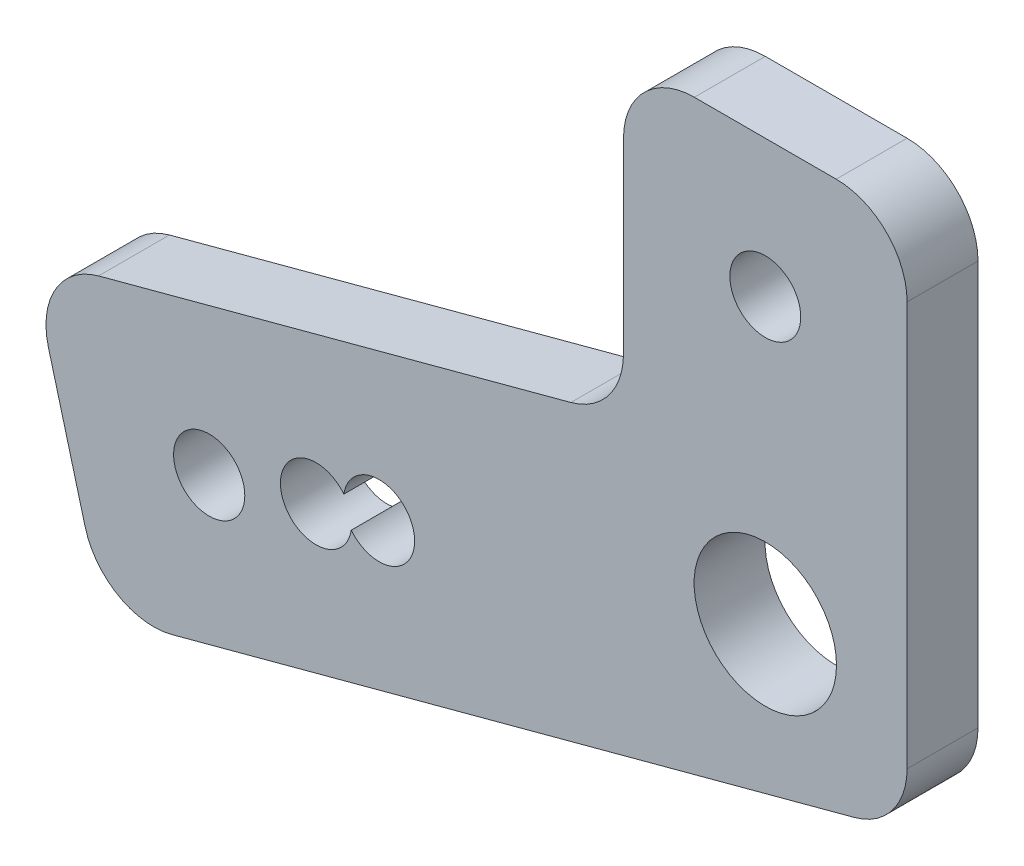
SolidWorks part; units mm, degrees
ref_plane "Front Plane" through (0, 0, 0) normal (0, 0, 1) x (1, 0, 0)
ref_plane "Top Plane" through (0, 0, 0) normal (0, 1, 0) x (1, 0, 0)
ref_plane "Right Plane" through (0, 0, 0) normal (1, 0, 0) x (0, 0, -1)
sketch "Sketch1" plane through (0, 0, 0) normal (0, 0, 1) x (1, 0, 0)
  line L0 (0, 0) -> (0, 60.96) construction
  line L1 (0, 0) -> (-49.8051, -13.3452) construction
  line L2 (-12.7, 9.7451) -> (-12.7, 37.6851)
  line L3 (12.7, -9.7451) -> (12.7, 37.6851)
  line L4 (12.7, -9.7451) -> (-59.276, -29.031)
  line L5 (-59.276, -29.031) -> (-65.85, -4.4965)
  line L6 (-65.85, -4.4965) -> (-12.7, 9.7451)
  line L7 (-12.7, 37.6851) -> (12.7, 37.6851)
  line L8 (-24.9025, -6.6726) -> (-28.1895, 5.5946) construction
  line L9 (-24.9025, -6.6726) -> (-21.6155, -18.9399) construction
  line L10 (-12.7, 25.4) -> (0, 25.4) construction
  line L11 (0, 25.4) -> (12.7, 25.4) construction
  arc A0 (-37.0848, -11.2583) -> (-37.7455, -8.7925) centre (-34.5937, -9.2693) ccw
  arc A1 (-37.7455, -8.7925) -> (-37.0848, -11.2583) centre (-40.2366, -10.7814) ccw
  circle A2 centre (-49.8051, -13.3452) radius 3.1877
  circle A3 centre (0, 0) radius 6.3754
  circle A4 centre (0, 25.4) radius 3.175
  point P23 (0, 0)
  point P25 (0, 0)
  point P26 (0, 0)
  dimension "D2" = 6.3754
  dimension "D3" = 51.562
  dimension "D4" = 35.814
  dimension "D5" = 41.656
  dimension "D6" = 12.7508
  dimension "D7" = 6.35
  dimension "D8" = 25.4
  dimension "D1" = 105
  dimension "D9" = 25.4
  dimension "D10" = 27.94
  dimension "D11" = 105
  dimension "D12" = 13.208
extrude "Boss-Extrude1" add sketch "Sketch1" along normal blind 6.35
fillet "Fillet1" radius 6.35 6 edges at (-65.85, -4.4965, 3.175) (-59.276, -29.031, 3.175) (12.7, -9.7451, 3.175) (12.7, 37.6851, 3.175) (-12.7, 37.6851, 3.175) (-12.7, 9.7451, 3.175)
